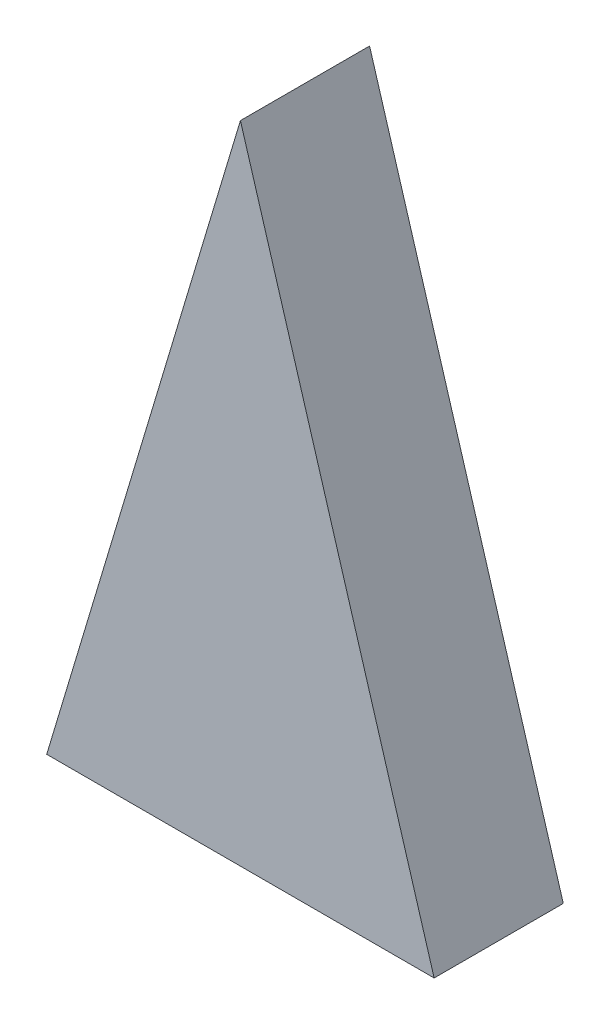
SolidWorks part; units mm, degrees
ref_plane "Front Plane" through (0, 0, 0) normal (0, 0, 1) x (1, 0, 0)
ref_plane "Top Plane" through (0, 0, 0) normal (0, 1, 0) x (1, 0, 0)
ref_plane "Right Plane" through (0, 0, 0) normal (1, 0, 0) x (0, 0, -1)
sketch "Sketch1" plane through (0, 0, 0) normal (0, 0, 1) x (1, 0, 0)
  line L0 (0, 0) -> (7.5, 25)
  line L1 (7.5, 25) -> (15, 0)
  line L2 (15, 0) -> (0, 0)
  dimension "D1" = 15
  dimension "D2" = 7.5
  dimension "D3" = 25
extrude "Boss-Extrude1" add sketch "Sketch1" along normal blind 5
